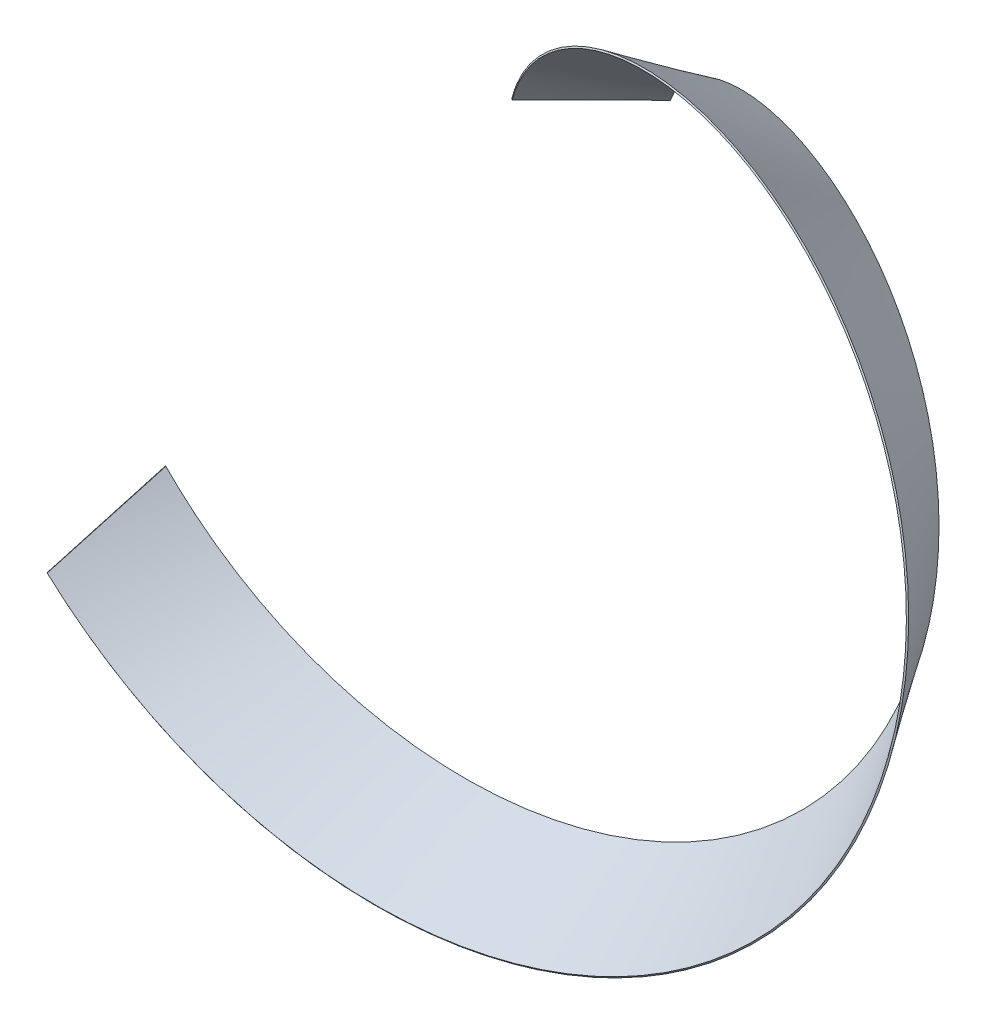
SolidWorks part; units mm, degrees
ref_plane "Ebene vorne" through (0, 0, 0) normal (0, 0, 1) x (1, 0, 0)
ref_plane "Ebene oben" through (0, 0, 0) normal (0, 1, 0) x (1, 0, 0)
ref_plane "Ebene rechts" through (0, 0, 0) normal (1, 0, 0) x (0, 0, -1)
sketch "Skizze2" plane through (0, 0, 0) normal (0, 0, 1) x (1, 0, 0)
  circle A0 centre (0, 0) radius 150
  dimension "D1" = 300
curve "Spirale/Helix1"
ref_plane "Ebene1" through (-106.066, 106.066, 0) normal (0.4786, 0.8274, 0.2939) x (-0.878, 0.4509, 0.1603)
sketch "Skizze3" plane through (-106.066, 106.066, 0) normal (0.4786, 0.8274, 0.2939) x (-0.878, 0.4509, 0.1603)
  line L0 (0, 0) -> (70.7107, 70.7107)
  line L1 (0, 0) -> (148.9965, 0) construction
  dimension "D1" = 45
  dimension "D2" = 100
surface "Oberfläche-Austragung1"
sketch3d "3D-Skizze2"
  spline S0 degree 3 poles (806.49, 292.9462, -56.6127) (-112.9021, -408.4128, -8.1874) (-292.9746, -3.8668, 42.4261) (-114.226, 189.2431, 97.965) (-94.7806, 204.3811, 102.965) (-50.8232, 227.9164, 112.965) (-26.3174, 236.3045, 117.965) (25.3651, 244.6919, 127.965) (52.5326, 244.6845, 132.965) (106.6261, 235.4938, 142.965) (133.5411, 226.3073, 147.965) (184.0111, 198.9867, 157.965) (207.5542, 180.8531, 162.965) (248.3082, 136.9248, 172.965) (265.5078, 111.1346, 177.965) (291.105, 54.1588, 187.965) (299.4931, 22.9817, 192.965) (305.8186, -41.719, 202.965) (303.7496, -75.2313, 207.965) (288.5752, -141.0689, 217.965) (275.4673, -173.381, 222.965) (238.8266, -233.1711, 232.965) (215.2958, -260.6355, 237.965) (173.5416, -295.6889, 245.465) (158.5563, -306.3531, 247.965) (126.7804, -325.2835, 252.965) (109.99, -333.5493, 255.465) (74.993, -347.3788, 260.465) (56.7868, -352.9422, 262.965) (19.3982, -361.1267, 267.965) (0.2163, -363.7476, 270.465) (-38.6432, -365.8794, 275.465) (-58.3204, -365.3902, 277.965) (-97.6617, -361.2131, 282.965) (-117.3255, -357.5252, 285.465) (-156.1162, -346.9461, 290.465) (-175.2428, -340.0548, 292.965) (-212.4341, -323.1503, 297.965) (-230.4985, -313.1371, 300.465) (-265.0536, -290.1568, 305.465) (-281.5438, -277.1896, 307.965) (-503.8562, -71.3112, 343.9122) (-526.356, 361.9703, 377.3495) (163.4229, 642.9203, 411.174) knots -0.569236 -0.569236 -0.569236 -0.569236 0.0625 0.0625 0.125 0.125 0.1875 0.1875 0.25 0.25 0.3125 0.3125 0.375 0.375 0.4375 0.4375 0.5 0.5 0.5625 0.5625 0.625 0.625 0.6875 0.6875 0.71875 0.71875 0.75 0.75 0.78125 0.78125 0.8125 0.8125 0.84375 0.84375 0.875 0.875 0.90625 0.90625 0.9375 0.9375 0.96875 0.96875 1.38684 1.38684 1.38684 1.38684 only from (-168.147, 114.2761, 77.965) to (-340.0777, -216.0304, 317.965) construction
  spline S1 degree 3 poles (-168.147, 114.2761, 77.965) (-159.148, 134.8481, 82.9643) (-146.4104, 154.4729, 87.965) (-114.226, 189.2431, 97.965) (-94.7806, 204.3811, 102.965) (-50.8232, 227.9164, 112.965) (-26.3174, 236.3045, 117.965) (25.3651, 244.6919, 127.965) (52.5326, 244.6845, 132.965) (106.6261, 235.4938, 142.965) (133.5411, 226.3073, 147.965) (184.0111, 198.9867, 157.965) (207.5542, 180.8531, 162.965) (248.3082, 136.9248, 172.965) (265.5078, 111.1346, 177.965) (291.105, 54.1588, 187.965) (299.4931, 22.9817, 192.965) (305.8186, -41.719, 202.965) (303.7496, -75.2313, 207.965) (288.5752, -141.0689, 217.965) (275.4673, -173.381, 222.965) (238.8266, -233.1711, 232.965) (215.2958, -260.6355, 237.965) (173.5416, -295.6889, 245.465) (158.5563, -306.3531, 247.965) (126.7804, -325.2835, 252.965) (109.99, -333.5493, 255.465) (74.993, -347.3788, 260.465) (56.7868, -352.9422, 262.965) (19.3982, -361.1267, 267.965) (0.2163, -363.7476, 270.465) (-38.6432, -365.8794, 275.465) (-58.3204, -365.3902, 277.965) (-97.6617, -361.2131, 282.965) (-117.3255, -357.5252, 285.465) (-156.1162, -346.9461, 290.465) (-175.2428, -340.0548, 292.965) (-212.4341, -323.1503, 297.965) (-230.4985, -313.1371, 300.465) (-265.0536, -290.1568, 305.465) (-281.5438, -277.1896, 307.965) (-312.4659, -248.5534, 312.965) (-326.897, -232.8849, 315.465) (-340.0777, -216.0304, 317.965) knots 0 0 0 0 0.0625 0.0625 0.125 0.125 0.1875 0.1875 0.25 0.25 0.3125 0.3125 0.375 0.375 0.4375 0.4375 0.5 0.5 0.5625 0.5625 0.625 0.625 0.6875 0.6875 0.71875 0.71875 0.75 0.75 0.78125 0.78125 0.8125 0.8125 0.84375 0.84375 0.875 0.875 0.90625 0.90625 0.9375 0.9375 0.96875 0.96875 1 1 1 1
delete or keep bodies "Körper-Löschen1" type delete bodies bodies 102
sketch3d "3D-Skizze3"
  spline S1 degree 3 number of poles 66 (-106.066, 106.066, 0) -> (-313.0854, -159.525, 240)
  spline S2 degree 3 number of poles 66 (-106.066, 106.066, 0) -> (-313.0854, -159.525, 240)
  dimension "D1" = 0
sheet metal parameters "Blech1" thickness 1.5 parameters "D1"=0.5, "Dicke"=1.5
lofted bend "Ausgeformte Biegungen1" parameters "D1"=0, "D12"=1.5
other "Freiform-Biegung1" parameters "D1"=1000, "D4"=57.296, "D5"=1
flat pattern "Abwicklung1"
sketch "Biegung-Linien1" plane through (-79.7461, 59.5887, -69.7742) normal (-0.656, 0.4902, -0.574) x (-0.4598, 0.3436, 0.8189)
  line L0 (85.206, 21.4767) -> (180.4144, -9.1069) construction
  line L1 (-789.8763, 103.6595) -> (-871.1438, 161.9312) construction
other "Abwickeln-<Freiform-Biegung1>1"
